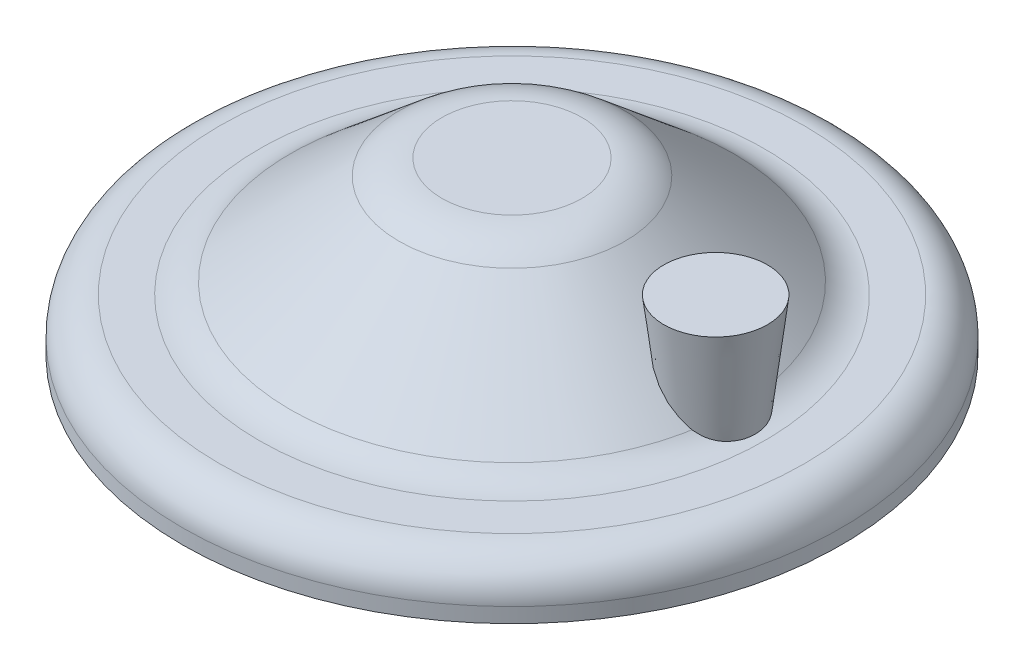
SolidWorks part; units mm, degrees
other "target"
other "tool"
ref_plane "Front Plane" through (0, 0, 0) normal (0, 0, 1) x (1, 0, 0)
ref_plane "Top Plane" through (0, 0, 0) normal (0, 1, 0) x (1, 0, 0)
ref_plane "Right Plane" through (0, 0, 0) normal (1, 0, 0) x (0, 0, -1)
sketch "Sketch1" plane through (0, 0, 0) normal (0, 0, -1) x (1, 0, 0)
  line L0 (79, 0) -> (68.2446, 0)
  line L1 (59.8708, -3.0562) -> (30.525, -27.7684)
  line L2 (18.9306, -32) -> (0, -32)
  line L3 (0, -32) -> (0, 0) construction
  line L4 (89, 10) -> (89, 14)
  arc A0 (68.2446, 0) -> (59.8708, -3.0562) centre (68.2446, -13) ccw
  arc A1 (30.525, -27.7684) -> (18.9306, -32) centre (18.9306, -14) cw
  arc A2 (79, 0) -> (89, 10) centre (79, 10) ccw
  point P10 (25.5, -32)
  point P11 (63.5, 0)
  point P15 (89, 0)
  dimension "D1" = 13
  dimension "D2" = 18
  dimension "D8" = 10
  dimension "D3" = 178
  dimension "D4" = 51
  dimension "D5" = 127
  dimension "D6" = 32
  dimension "D7" = 46
revolve "Revolve-Thin1" add sketch "Sketch1" angle 360 about L3
sketch "Sketch2" plane through (0, 0, 0) normal (0, 0, 1) x (1, 0, 0)
  line L0 (55, 27.5) -> (55, 40.281) construction
  line L1 (41, 27.5) -> (55, 27.5)
  line L2 (41, 27.5) -> (44.5, -1.5)
  line L3 (44.5, -1.5) -> (55, -1.5)
  line L4 (55, -1.5) -> (55, 27.5)
  line L5 (55, -1.5) -> (55, 27.5) construction
  line L8 (-89, -14) -> (89, -14) construction
  point P1 (49.75, -1.5)
  dimension "D1" = 28
  dimension "D2" = 21
  dimension "D3" = 55
  dimension "D4" = 12.5
  dimension "D5" = 29
revolve "Revolve1" add sketch "Sketch2" angle 360 about L0
fillet "Fillet1" radius 0.8 1 edges at (65.5, -1.5, 0)
